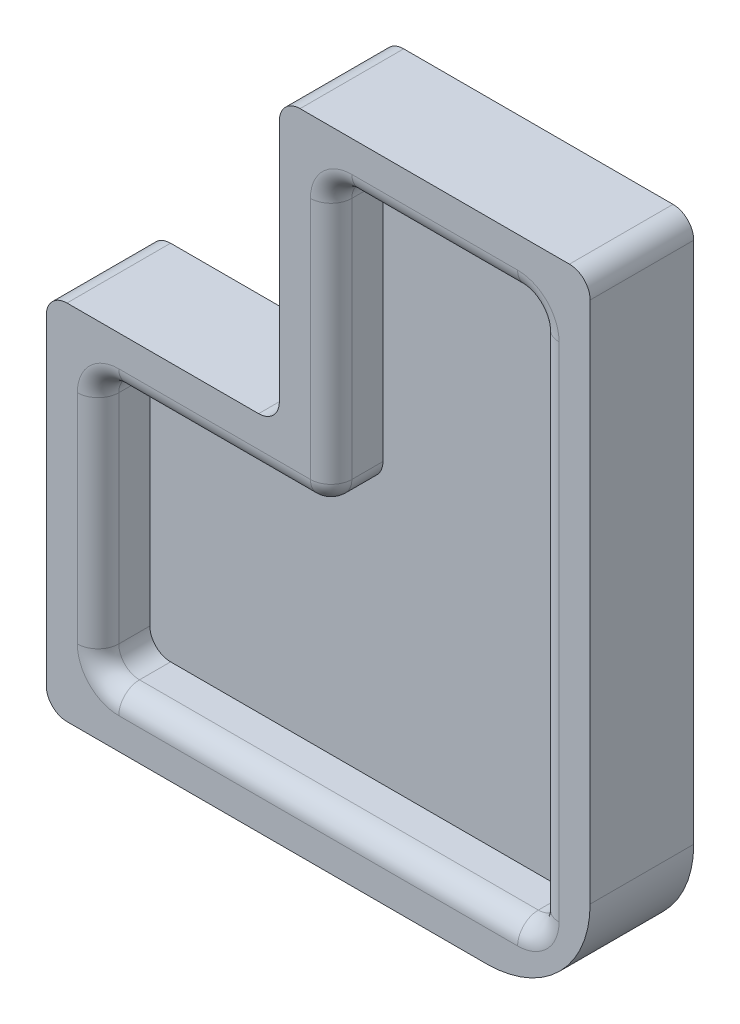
SolidWorks part; units mm, degrees
ref_plane "Płaszczyzna przednia" through (0, 0, 0) normal (0, 0, 1) x (1, 0, 0)
ref_plane "Płaszczyzna górna" through (0, 0, 0) normal (0, 1, 0) x (1, 0, 0)
ref_plane "Płaszczyzna prawa" through (0, 0, 0) normal (1, 0, 0) x (0, 0, -1)
sketch "Szkic1" plane through (0, 0, 0) normal (0, 0, 1) x (1, 0, 0)
  line L0 (0, 0) -> (0, 70)
  line L1 (0, 70) -> (45, 70)
  line L2 (45, 70) -> (45, 125)
  line L3 (45, 125) -> (105, 125)
  line L4 (105, 125) -> (105, 0)
  line L5 (105, 0) -> (0, 0)
  dimension "D1" = 105
  dimension "D2" = 125
  dimension "D3" = 70
  dimension "D4" = 60
extrude "Dodanie-wyciągnięcie1" add sketch "Szkic1" along normal blind 20
sketch "Szkic2" plane through (0, 0, 20) normal (0, 0, 1) x (1, 0, 0)
  line L20 (10, 10) -> (95, 10)
  line L21 (95, 10) -> (95, 115)
  line L22 (95, 115) -> (55, 115)
  line L23 (55, 115) -> (55, 60)
  line L24 (55, 60) -> (10, 60)
  line L25 (10, 60) -> (10, 10)
  line L26 (10, 10) -> (95, 10)
  line L27 (95, 10) -> (95, 115)
  line L28 (95, 115) -> (55, 115)
  line L29 (55, 115) -> (55, 60)
  line L30 (55, 60) -> (10, 60)
  line L31 (10, 60) -> (10, 10)
  dimension "D1" = 10
extrude "Wytnij-wyciągnięcie1" cut sketch "Szkic2" against normal blind 10
fillet "Zaokrąglenie2" radius 4 6 edges at (95, 62.5, 20) (75, 115, 20) (55, 87.5, 20) (32.5, 60, 20) (52.5, 10, 20) (10, 35, 20)
fillet "Zaokrąglenie3" radius 4 12 edges at (8.8284, 61.1716, 18.8284) (53.8284, 116.1716, 18.8284) (96.1716, 116.1716, 18.8284) (96.1716, 8.8284, 18.8284) (8.8284, 8.8284, 18.8284) (53.8284, 61.1716, 18.8284) (10, 60, 13) (55, 115, 13) (95, 115, 13) (95, 10, 13) (10, 10, 13) (55, 60, 13)
other "Zaokrąglenie narożnika2"
other "Zaokrąglenie narożnika4"
other "Zaokrąglenie narożnika8"
other "Zaokrąglenie narożnika9"
other "Zaokrąglenie narożnika10"
fillet "Zaokrąglenie6" radius 20 1 edges at (105, 0, 10)
fillet "Zaokrąglenie5" radius 4 5 edges at (0, 0, 10) (0, 70, 10) (45, 70, 10) (45, 125, 10) (105, 125, 10)
